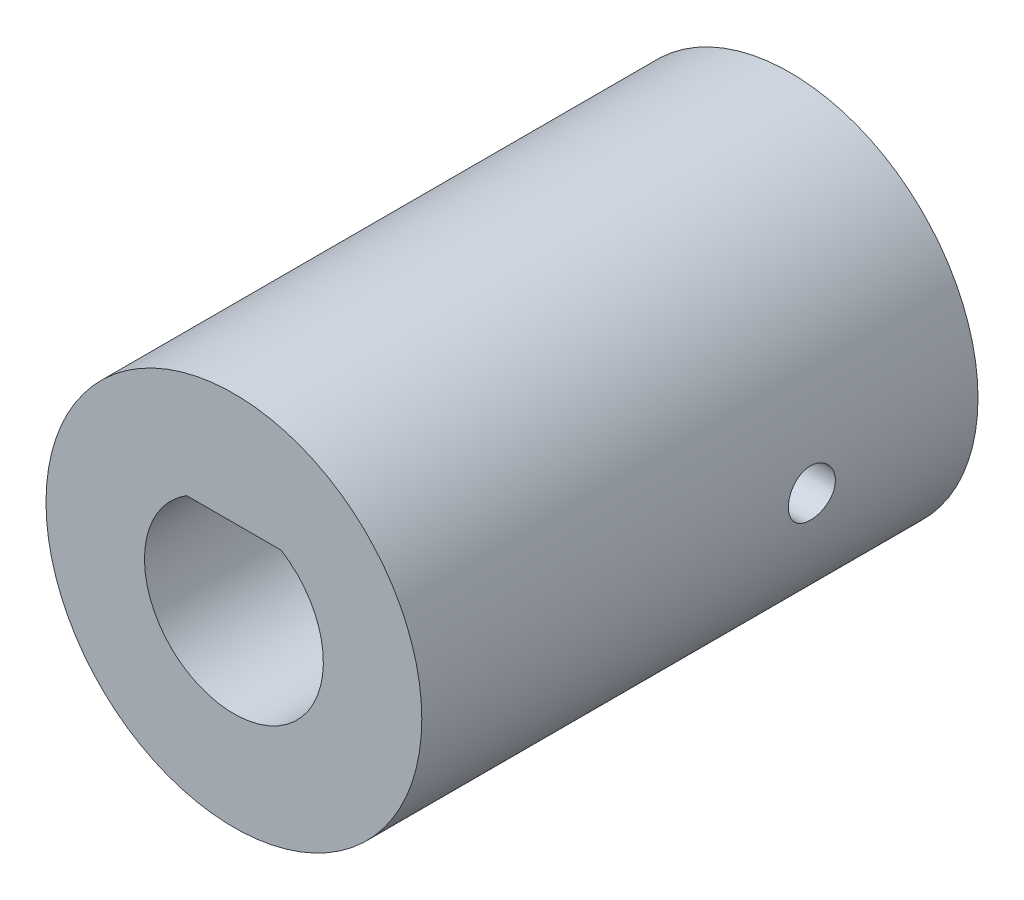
SolidWorks part; units mm, degrees
ref_plane "Plane1" through (0, 0, 0) normal (0, 0, 1) x (1, 0, 0)
ref_plane "Plane2" through (0, 0, 0) normal (0, 1, 0) x (1, 0, 0)
ref_plane "Plane3" through (0, 0, 0) normal (1, 0, 0) x (0, 0, -1)
sketch "Sketch1" plane through (0, 0, 0) normal (0, 0, 1) x (1, 0, 0)
  circle A0 centre (0, 0) radius 6.35
extrude "Base-Extrude" add sketch "Sketch1" along normal blind 18.796
sketch "Sketch2" plane through (0, 0, 18.796) normal (0, 0, 1) x (1, 0, 0)
  line L1 (0, 2.5654) -> (1.5984, 2.5654)
  line L2 (0, 2.5654) -> (-1.5984, 2.5654)
  arc A0 (-1.5984, 2.5654) -> (1.5984, 2.5654) centre (0, 0) ccw
extrude "Cut-Extrude1" cut sketch "Sketch2" against normal through all
sketch "Sketch4" plane through (0, 0, 0) normal (1, 0, 0) x (0, 0, -1)
  line L0 (-18.796, 0) -> (0, 0) construction
  circle A0 centre (-5.6134, 0) radius 0.7938
extrude "Cut-Extrude3" cut sketch "Sketch4" against normal through all and the other way through all
